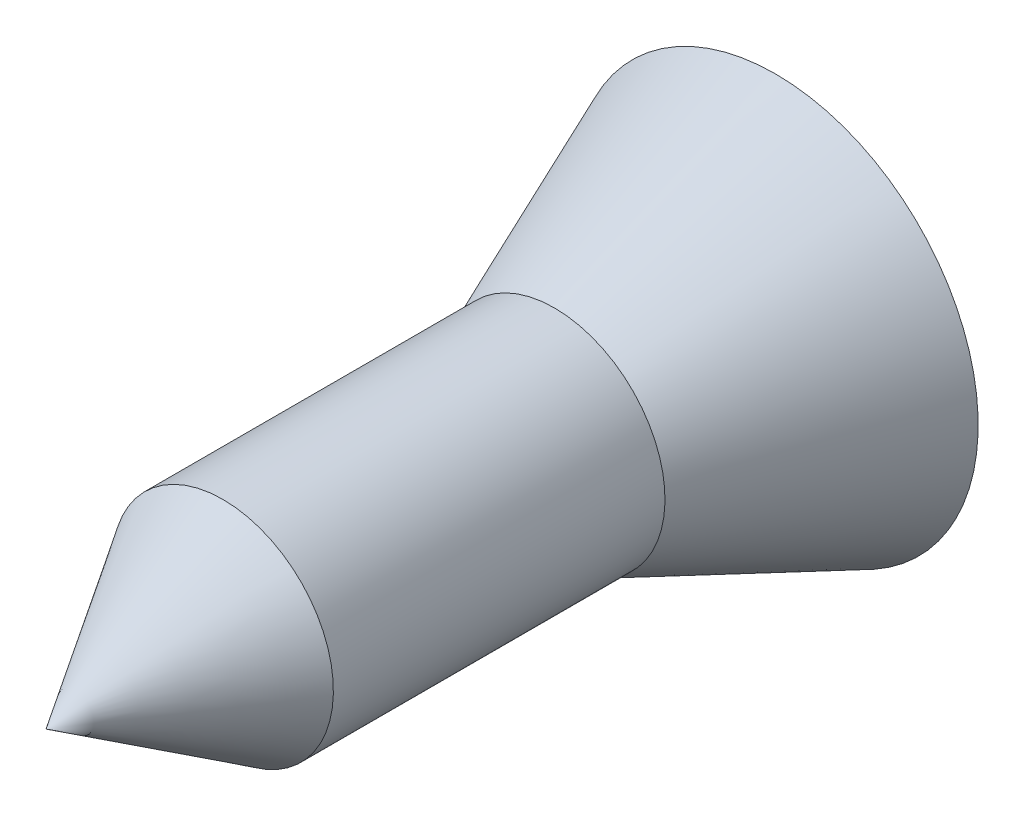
SolidWorks part; units mm, degrees
ref_plane "Front Plane" through (0, 0, 0) normal (0, 0, 1) x (1, 0, 0)
ref_plane "Top Plane" through (0, 0, 0) normal (0, 1, 0) x (1, 0, 0)
ref_plane "Right Plane" through (0, 0, 0) normal (1, 0, 0) x (0, 0, -1)
ref_plane "Plane1" through (0, 0, 0) normal (0, -1, 0) x (1, 0, 0)
sketch "Sketch1" plane through (0, 0, 0) normal (0, -1, 0) x (1, 0, 0)
  line L0 (2.9, 4.1) -> (1.4, 6.5)
  line L1 (1.4, 6.5) -> (1.4, -3.4)
  line L2 (1.4, -3.4) -> (4.15, -3.4)
  line L3 (2.9, -0.4) -> (4.15, -3.4)
  line L6 (2.9, -0.4) -> (2.9, 4.1)
  line L8 (1.4, 6.5) -> (1.4, -3.4) construction
  dimension "D1" = 2.75
  dimension "D2" = 1.5
  dimension "D6" = 3
  dimension "D7" = 7.5
  dimension "D8" = 9.9
revolve "Revolve1" add sketch "Sketch1" angle 360 about L8
